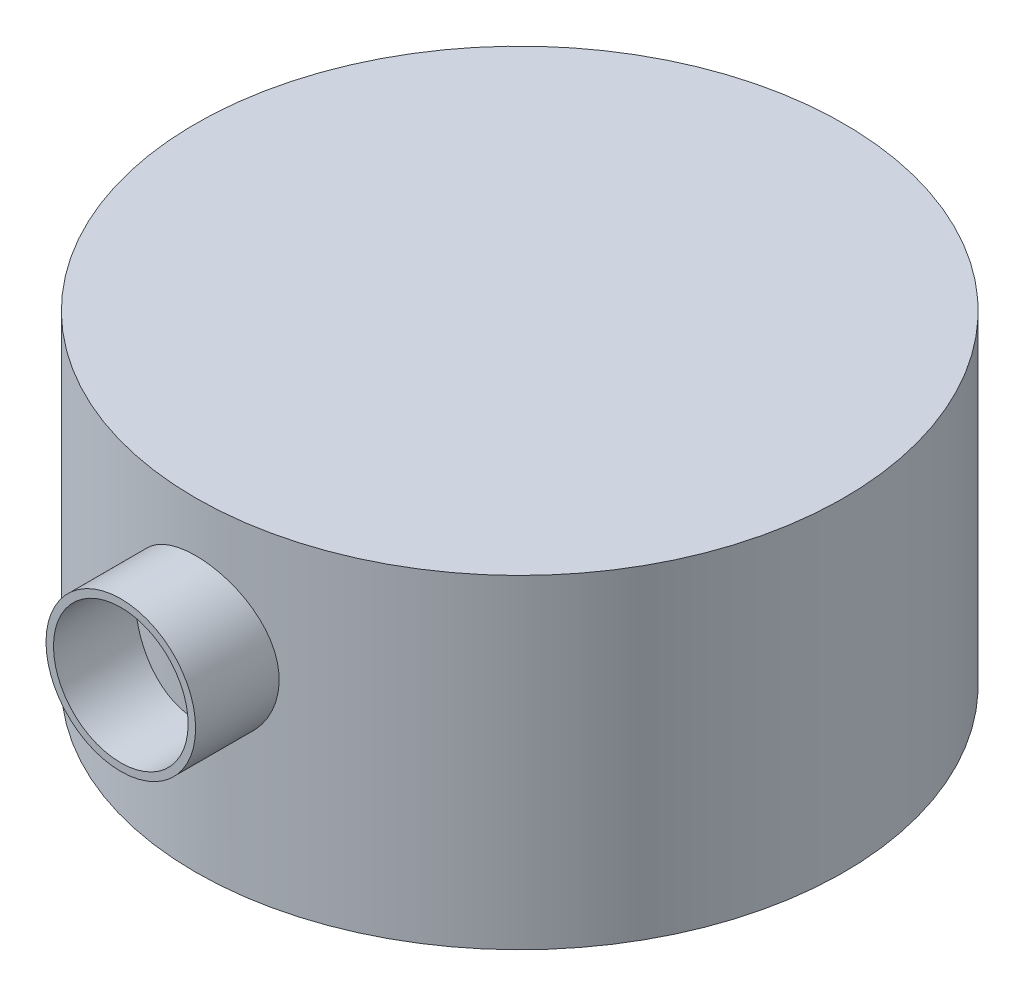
SolidWorks part; units mm, degrees
ref_plane "Plan de face" through (0, 0, 0) normal (0, 0, 1) x (1, 0, 0)
ref_plane "Plan de dessus" through (0, 0, 0) normal (0, 1, 0) x (1, 0, 0)
ref_plane "Plan de droite" through (0, 0, 0) normal (1, 0, 0) x (0, 0, -1)
sketch "Esquisse1" plane through (0, 0, 0) normal (0, 1, 0) x (1, 0, 0)
  circle A0 centre (0, 0) radius 65
  dimension "D1" = 130
extrude "Extrusion1" add sketch "Esquisse1" along normal blind 65
sketch "Esquisse2" plane through (0, 0, 0) normal (0, 0, 1) x (1, 0, 0)
  circle A0 centre (0, 40) radius 13.5
  circle A1 centre (0, 40) radius 15
  dimension "D1" = 30
  dimension "D2" = 27
  dimension "D3" = 40
extrude "Extrusion2" add sketch "Esquisse2" along normal blind 80
